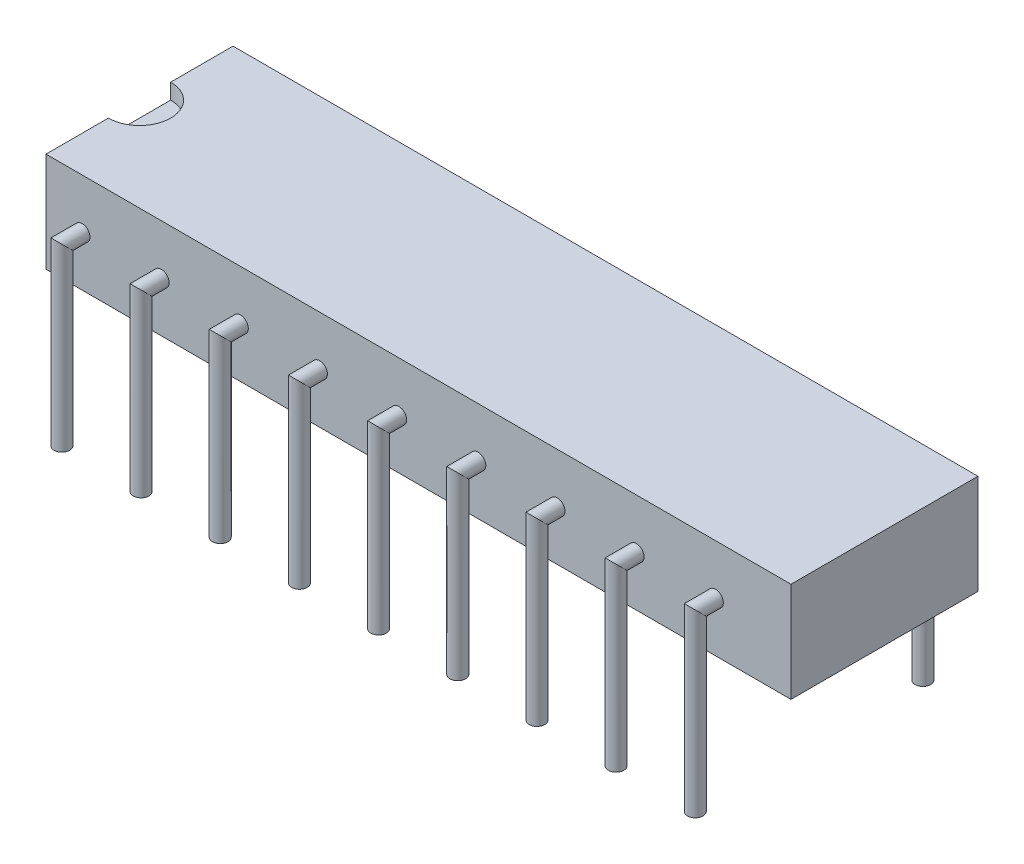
SolidWorks part; units mm, degrees
ref_plane "Plan de face" through (0, 0, 0) normal (0, 0, 1) x (1, 0, 0)
ref_plane "Plan de dessus" through (0, 0, 0) normal (0, 1, 0) x (1, 0, 0)
ref_plane "Plan de droite" through (0, 0, 0) normal (1, 0, 0) x (0, 0, -1)
sketch "Esquisse1" plane through (0, 0, 0) normal (1, 0, 0) x (0, 0, -1)
  line L0 (-34.0084, 0) -> (28.7946, 0) construction
  line L1 (0, -15.76) -> (0, 25.9507) construction
  line L2 (-13.1897, 3.2) -> (13.1184, 3.2) construction
  line L3 (3, 10.112) -> (3, -6.1718) construction
  line L4 (-3, 10.112) -> (-3, -4.99) construction
  line L6 (-3, 3.2) -> (3, 3.2)
  line L7 (-3, 3.2) -> (-3, 0)
  line L8 (-3, 0) -> (3, 0)
  line L9 (3, 3.2) -> (3, 0)
  dimension "D1" = 3
  dimension "D2" = 6
  dimension "D3" = 3.2
extrude "Extrusion1" add sketch "Esquisse1" along normal blind 23.9
sketch "Esquisse2" plane through (0, 3.2, 0) normal (0, 1, 0) x (-1, 0, 0)
  line L0 (0, -1) -> (0, 1)
  arc A0 (0, 1) -> (0, -1) centre (0, 0) ccw
extrude "Enlèv. mat.-Extru.1" cut sketch "Esquisse2" against normal blind 0.5
sketch "Esquisse3" plane through (0, 0, 3) normal (0, 0, 1) x (1, 0, 0)
  line L0 (-0.9705, 0) -> (10.7632, 0) construction
  line L1 (0, 4.319) -> (0, -1.0907) construction
  line L2 (-0.7349, 1.6) -> (2.3847, 1.6) construction
  line L3 (1.16, 2.698) -> (1.16, -1.0907) construction
  circle A0 centre (1.16, 1.6) radius 0.25
  dimension "D1" = 1.6
  dimension "D2" = 1.16
ref_plane "Plan1" through (1.16, 0, 0) normal (1, 0, 0) x (0, 0, -1)
sketch "Esquisse5" plane through (1.16, 0, 0) normal (1, 0, 0) x (0, 0, -1)
  line L0 (-4.2866, 0) -> (4.976, 0) construction
  line L1 (-3, -1.7147) -> (-3, 5.2592) construction
  line L2 (-4.2866, -4) -> (4.976, -4) construction
  line L3 (-3.65, -4.4343) -> (-3.65, 4.8284) construction
  line L4 (-3.7349, 1.6) -> (-3, 1.6) construction
  line L5 (-3, 1.6) -> (-3.65, 1.6)
  line L6 (-3.65, 1.6) -> (-3.65, -4)
  dimension "D1" = 4
  dimension "D2" = 0.65
sweep "Balayage1" add profiles "Esquisse3" path "Esquisse5"
ref_plane "Plan2" through (0, 0, 0) normal (0, 0, 1) x (1, 0, 0)
mirror "Symétrie1" about plane through (0, 0, 0) normal (0, 0, 1) of "Balayage1"
pattern_linear "Répétition linéaire1" count 9 spacing 2.54 along (1, 0, 0) of "Balayage1", "Symétrie1"
